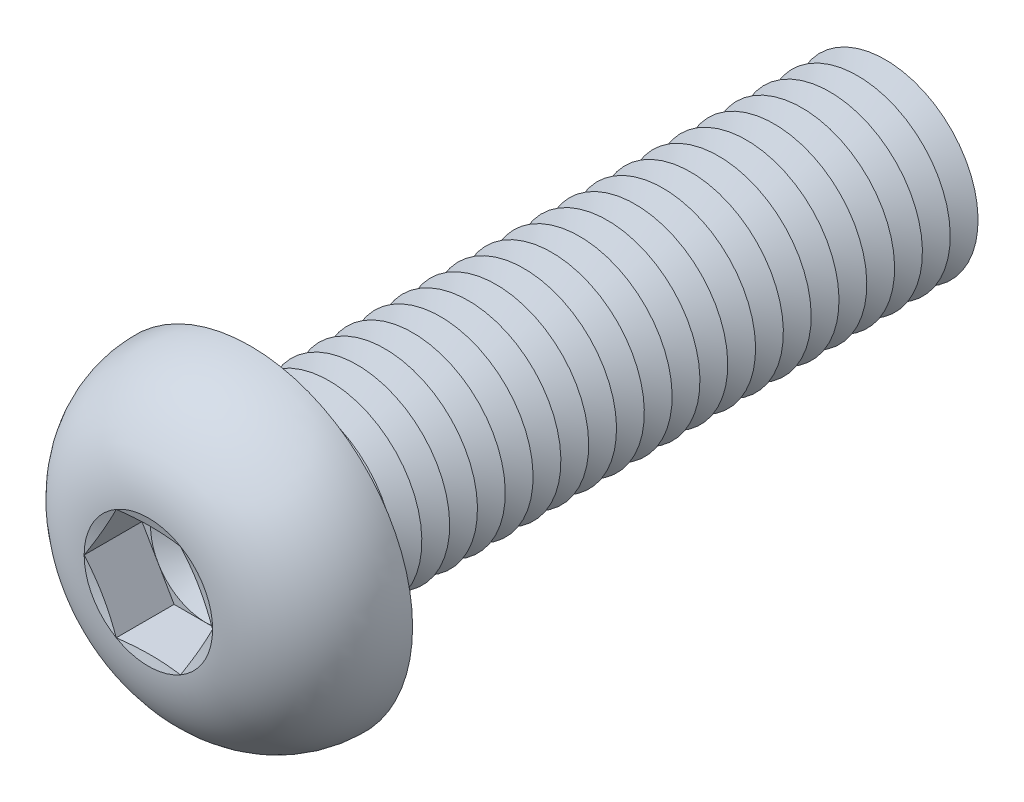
SolidWorks part; units mm, degrees
ref_plane "Front Plane" through (0, 0, 0) normal (0, 0, 1) x (1, 0, 0)
ref_plane "Top Plane" through (0, 0, 0) normal (0, 1, 0) x (1, 0, 0)
ref_plane "Right Plane" through (0, 0, 0) normal (1, 0, 0) x (0, 0, -1)
sketch "Sketch1" plane through (0, 0, 0) normal (1, 0, 0) x (0, 0, -1)
  line L0 (0, 5) -> (0, 8.75)
  line L3 (0, 5) -> (35, 5)
  line L4 (35, 5) -> (35, 0)
  line L5 (35, 0) -> (-5.5, 0) construction
  line L6 (-5.5, 0) -> (35, 0)
  line L7 (-5.5, 3.4641) -> (-5.5, 1.732) construction
  line L8 (-5.5, 1.732) -> (-5.5, 0)
  line L9 (-5.5, 3.4641) -> (-5.0359, 1.732)
  line L10 (-5.0359, 1.732) -> (-5.5, 1.732)
  line L11 (35, 0) -> (22.7481, 0) construction
  line L12 (0, 8.75) -> (-5.5, 8.75) construction
  arc A1 (0, 8.75) -> (-5.5, 3.4641) centre (0, 3.2457) ccw
  point P8 (35, 2.5)
  dimension "D1" = 17.5
  dimension "D2" = 10
  dimension "D3" = 5.5
  dimension "D4" = 6.9282
  dimension "D5" = 35
  dimension "D6" = 15
revolve "Revolve1" add sketch "Sketch1" angle 360 about L5
fillet "Fillet1" radius 0.75 1 edges at (0, 5, 0)
sketch "Sketch2" plane through (0, 0, 0) normal (1, 0, 0) x (0, 0, -1)
  line L0 (34.25, 5) -> (35.75, 5)
  line L1 (35, 5) -> (0.75, 5) construction
  line L2 (35.75, 5) -> (35, 3.701)
  line L3 (35, -5) -> (35, 5) construction
  line L4 (35, 3.701) -> (34.25, 5)
  dimension "D1" = 1.5
revolve "Cut-Revolve1" cut sketch "Sketch2" angle 360 about axis through (0, 0, -35) along (0, 0, -1)
pattern_linear "LPattern1" count 23 spacing 1.5 along (0, 0, 1) of "Cut-Revolve1"
sketch "Sketch3" plane through (0, 0, 5.5) normal (0, 0, 1) x (1, 0, 0)
  line L7 (1.732, 3) -> (-1.7321, 3)
  line L8 (-1.7321, 3) -> (-3.4641, 0)
  line L9 (-3.4641, 0) -> (-1.732, -3)
  line L10 (-1.732, -3) -> (1.732, -3)
  line L11 (1.732, -3) -> (3.4641, 0)
  line L12 (3.4641, 0) -> (1.732, 3)
  circle A0 centre (0, 0) radius 3 construction
  circle A3 centre (0, 0) radius 3.4641 construction
extrude "Cut-Extrude1" cut sketch "Sketch3" against normal blind 3.12
sketch "Sketch4" plane through (0, 0, 2.38) normal (0, 0, 1) x (1, 0, 0)
  line L1 (1.732, 3) -> (-1.7321, 3) construction
  circle A0 centre (0, 0) radius 3
extrude "Cut-Extrude2" cut sketch "Sketch4" against normal through all draft 60
